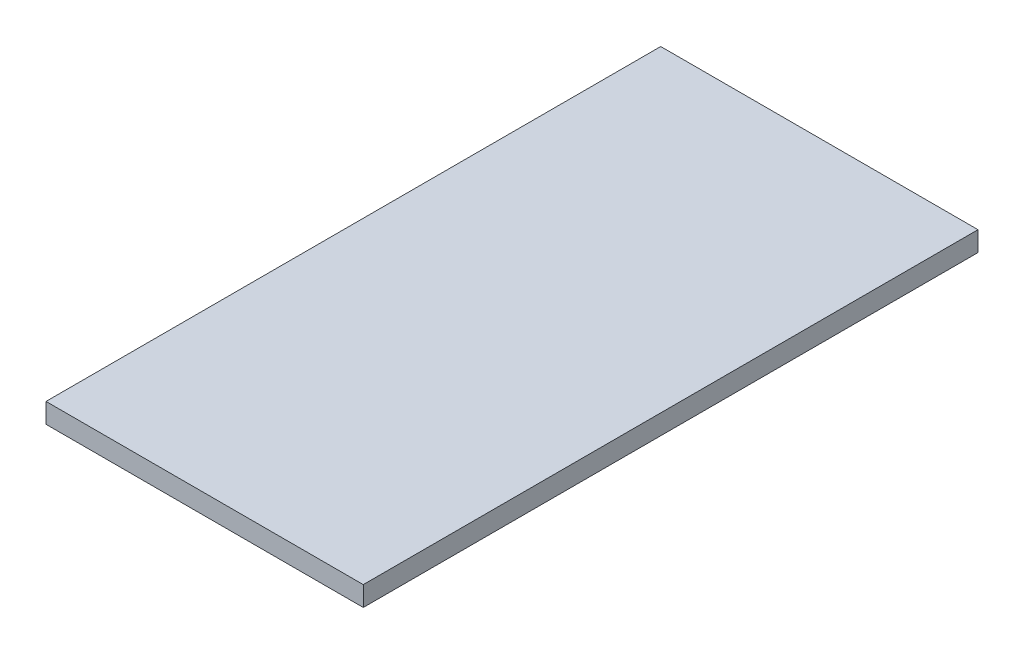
SolidWorks part; units mm, degrees
ref_plane "Plan de face" through (0, 0, 0) normal (0, 0, 1) x (1, 0, 0)
ref_plane "Plan de dessus" through (0, 0, 0) normal (0, 1, 0) x (1, 0, 0)
ref_plane "Plan de droite" through (0, 0, 0) normal (1, 0, 0) x (0, 0, -1)
sketch "Esquisse1" plane through (0, 0, 0) normal (0, 1, 0) x (1, 0, 0)
  line L1 (160, -310) -> (-160, -310)
  line L2 (160, -310) -> (160, 310)
  line L3 (160, 310) -> (-160, 310)
  line L4 (-160, -310) -> (-160, 310)
  line L5 (160, -310) -> (-160, 310) construction
  line L6 (160, 310) -> (-160, -310) construction
  point P0 (0, 0)
  dimension "D1" = 320
  dimension "D2" = 620
extrude "Boss.-Extru.1" add sketch "Esquisse1" along normal blind 20
